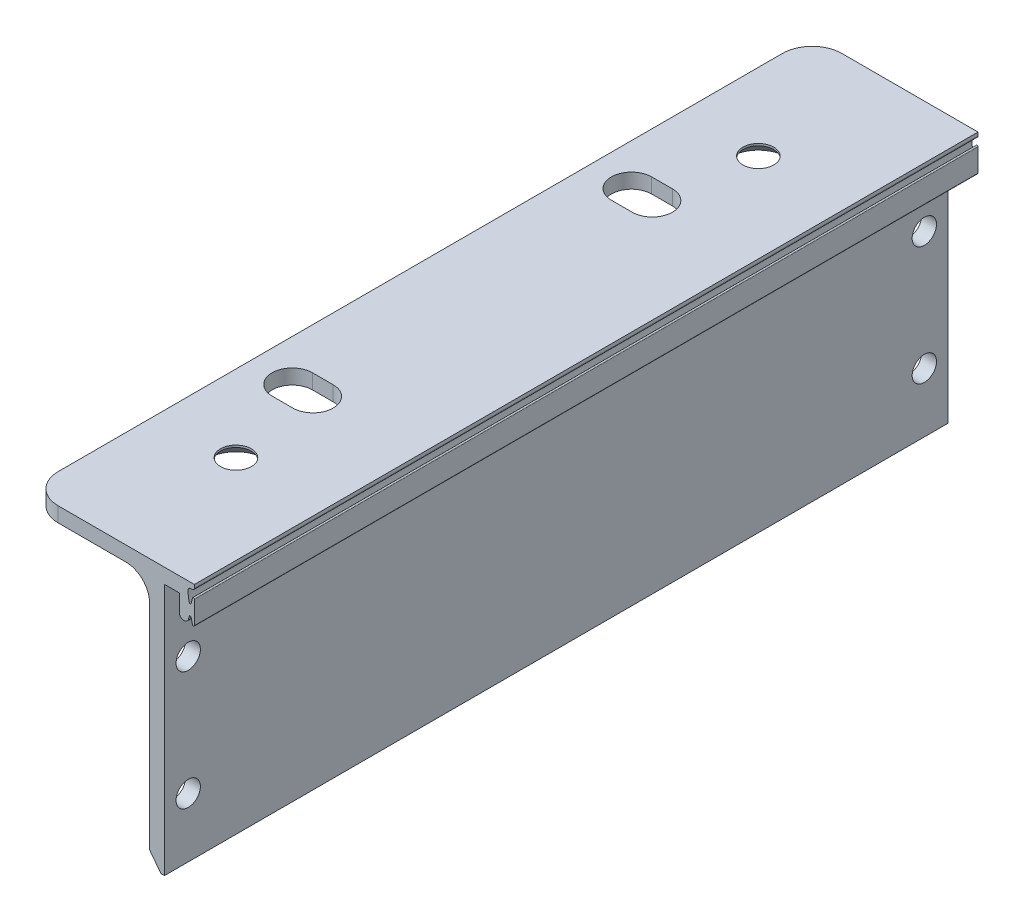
SolidWorks part; units mm, degrees
ref_plane "前视基准面" through (0, 0, 0) normal (0, 0, 1) x (1, 0, 0)
ref_plane "上视基准面" through (0, 0, 0) normal (0, 1, 0) x (1, 0, 0)
ref_plane "右视基准面" through (0, 0, 0) normal (1, 0, 0) x (0, 0, -1)
sketch "草图1" plane through (0, 0, 0) normal (0, 0, 1) x (1, 0, 0)
  line L1 (2137.4351, -3066.2715) -> (2137.4351, -3069.1377)
  line L2 (2139.9751, -3063.7715) -> (2139.9751, -3064.3461)
  line L886 (2138.9752, -3069.3427) -> (2139.1203, -3068.8072)
  line L887 (2137.4351, -3066.2715) -> (2137.4351, -3069.1377)
  line L888 (2134.9351, -3066.2715) -> (2137.4351, -3066.2715)
  line L889 (2139.4107, -3068.8105) -> (2139.6548, -3069.798)
  line L890 (2134.9351, -3066.2715) -> (2134.9351, -3108.7715)
  line L891 (2134.9351, -3108.7715) -> (2134.3351, -3108.7715)
  line L892 (2139.9751, -3065.934) -> (2139.9751, -3069.759)
  line L893 (2132.4351, -3106.2715) -> (2134.3351, -3108.7715)
  line L894 (2132.4351, -3070.2715) -> (2132.4351, -3106.2715)
  line L895 (2139.4107, -3066.8825) -> (2139.6548, -3065.895)
  line L896 (2112.0351, -3066.2715) -> (2128.4351, -3066.2715)
  line L897 (2112.0351, -3063.7715) -> (2112.0351, -3066.2715)
  line L898 (2112.0351, -3063.7715) -> (2139.9751, -3063.7715)
  line L899 (2139.9751, -3063.7715) -> (2139.9751, -3064.3461)
  line L900 (2139.174, -3064.7312) -> (2139.723, -3064.6423)
  arc A123 (2137.4351, -3069.1377) -> (2138.9752, -3069.3427) centre (2138.2188, -3069.1377) ccw
  arc A124 (2139.4107, -3068.8105) -> (2139.1203, -3068.8072) centre (2139.2651, -3068.8465) ccw
  arc A125 (2139.6548, -3069.798) -> (2139.9751, -3069.759) centre (2139.8126, -3069.759) ccw
  arc A126 (2139.9751, -3065.934) -> (2139.6548, -3065.895) centre (2139.8126, -3065.934) ccw
  arc A127 (2139.1161, -3066.864) -> (2139.4107, -3066.8825) centre (2139.2651, -3066.8465) ccw
  arc A128 (2138.9221, -3065.0153) -> (2139.1161, -3066.864) centre (2145.3632, -3065.274) ccw
  arc A129 (2139.174, -3064.7312) -> (2138.9221, -3065.0153) centre (2139.2219, -3065.0273) ccw
  arc A130 (2139.723, -3064.6423) -> (2139.9751, -3064.3461) centre (2139.6751, -3064.3461) ccw
  arc A131 (2132.4351, -3070.2715) -> (2128.4351, -3066.2715) centre (2128.4351, -3070.2715) ccw
extrude "凸台-拉伸1" add sketch "草图1" along normal mid plane 132 contours A131 L894 L893 L891 L890 L888 L1 A123 L886 A124 L889 A125 L892 A126 L895 A127 A128 A129 L900 A130 L2 L898 L897 L896
sketch "草图8" plane through (2132.4351, 0, 0) normal (-1, 0, 0) x (0, 0, 1)
  line L0 (-66, -3070.2715) -> (-66, -3106.2715) construction
  line L1 (66, -3063.7715) -> (-66, -3063.7715) construction
  line L2 (0, -3106.2715) -> (0, -3066.2715) construction
  line L3 (66, -3106.2715) -> (-66, -3106.2715) construction
  line L4 (66, -3066.2715) -> (-66, -3066.2715) construction
  circle A0 centre (-62, -3078.7715) radius 2.05
  circle A1 centre (-62, -3098.7715) radius 2.05
  circle A2 centre (62, -3098.7715) radius 2.05
  circle A3 centre (62, -3078.7715) radius 2.05
  dimension "D1" = 4.1
  dimension "D2" = 4.1
  dimension "D3" = 4
  dimension "D4" = 20
  dimension "D5" = 4
  dimension "D6" = 15
extrude "切除-拉伸7" cut sketch "草图8" against normal blind 132
sketch "草图2" plane through (0, -3063.7715, 0) normal (0, 1, 0) x (1, 0, 0)
  line L1 (2112.0351, -66) -> (2112.0351, 66) construction
  line L2 (2139.9751, 0) -> (2112.0351, 0) construction
  line L3 (2139.9751, -66) -> (2139.9751, 66) construction
  circle A0 centre (2122.0351, 50.825) radius 2.1
  circle A1 centre (2122.0351, -50.825) radius 2.1
  dimension "D1" = 4.2
  dimension "D3" = 10
  dimension "D2" = 101.65
extrude "切除-拉伸1" [suppressed] cut sketch "草图2" against normal through all
sketch "草图4" plane through (0, -3063.7715, 0) normal (0, 1, 0) x (1, 0, 0)
  line L0 (2119.0351, 28.575) -> (2122.5351, 28.575) construction
  line L2 (2119.0351, 31.975) -> (2122.5351, 31.975)
  line L3 (2119.0351, 25.175) -> (2122.5351, 25.175)
  line L4 (2112.0351, -66) -> (2112.0351, 66) construction
  line L5 (2139.9751, 0) -> (2112.0351, 0) construction
  line L6 (2139.9751, -66) -> (2139.9751, 66) construction
  line L7 (2119.0351, -28.575) -> (2122.5351, -28.575) construction
  line L8 (2119.0351, -31.975) -> (2122.5351, -31.975)
  line L9 (2119.0351, -25.175) -> (2122.5351, -25.175)
  arc A0 (2119.0351, 31.975) -> (2119.0351, 25.175) centre (2119.0351, 28.575) ccw
  arc A1 (2122.5351, 25.175) -> (2122.5351, 31.975) centre (2122.5351, 28.575) ccw
  arc A2 (2119.0351, -31.975) -> (2119.0351, -25.175) centre (2119.0351, -28.575) cw
  arc A3 (2122.5351, -25.175) -> (2122.5351, -31.975) centre (2122.5351, -28.575) cw
  point P4 (2120.7851, 28.575)
  point P17 (2120.7851, -28.575)
  dimension "D1" = 3.4
  dimension "D3" = 28.575
  dimension "D2" = 3.5
  dimension "D4" = 8.75
extrude "切除-拉伸2" cut sketch "草图4" against normal blind 132
fillet "圆角1" radius 5 2 edges at (2112.0351, -3065.0215, -66) (2112.0351, -3065.0215, 66)
hole_wizard "Ø5.2 (5.2) 直径孔1" positions "草图10" profile "草图9" hole size "Ø5.2" standard "Gb"
sketch "草图10" plane through (0, -3063.7715, 0) normal (0, 1, 0) x (1, 0, 0)
  line L0 (2139.9751, -66) -> (2139.9751, 66) construction
  line L1 (2112.0351, 0) -> (2139.9751, 0) construction
  line L2 (2112.0351, -61) -> (2112.0351, 61) construction
  point P0 (2124.9751, -44)
  point P2 (2124.9751, 44)
  dimension "D1" = 88
  dimension "D2" = 15
  dimension "D3" = 44
sketch "草图9" plane through (2124.9751, -3063.7715, 44) normal (1, 0, 0) x (0, 0, 1)
  line L0 (0, 0) -> (0, 8.5622)
  line L1 (0, 8.5622) -> (2.6, 7)
  line L2 (2.6, 7) -> (2.6, 0)
  line L5 (2.6, 0) -> (0, 0)
  line L10 (0, 8.5622) -> (-2.6, 7) construction
  line L11 (0, -6.35) -> (0, 107.95) construction
  dimension "孔直径" = 5.2
  dimension "孔深度" = 7
  dimension "导头角度" = 118
chamfer "倒角1" distance 2.15 angle 45 2 edges at (2122.3751, -3066.2715, -44) (2122.3751, -3066.2715, 44)
sketch "草图11" plane through (0, -3063.7715, 0) normal (0, 1, 0) x (1, 0, 0)
  line L0 (2112.0351, -61) -> (2112.0351, 61) construction
  line L1 (2117.0351, -66) -> (2139.9751, -66) construction
  circle A0 centre (2122.0351, -59.5) radius 3
  dimension "D1" = 10
  dimension "D3" = 6
  dimension "D2" = 6.5
extrude "凸台-拉伸2" add sketch "草图11" along normal blind 13.5
